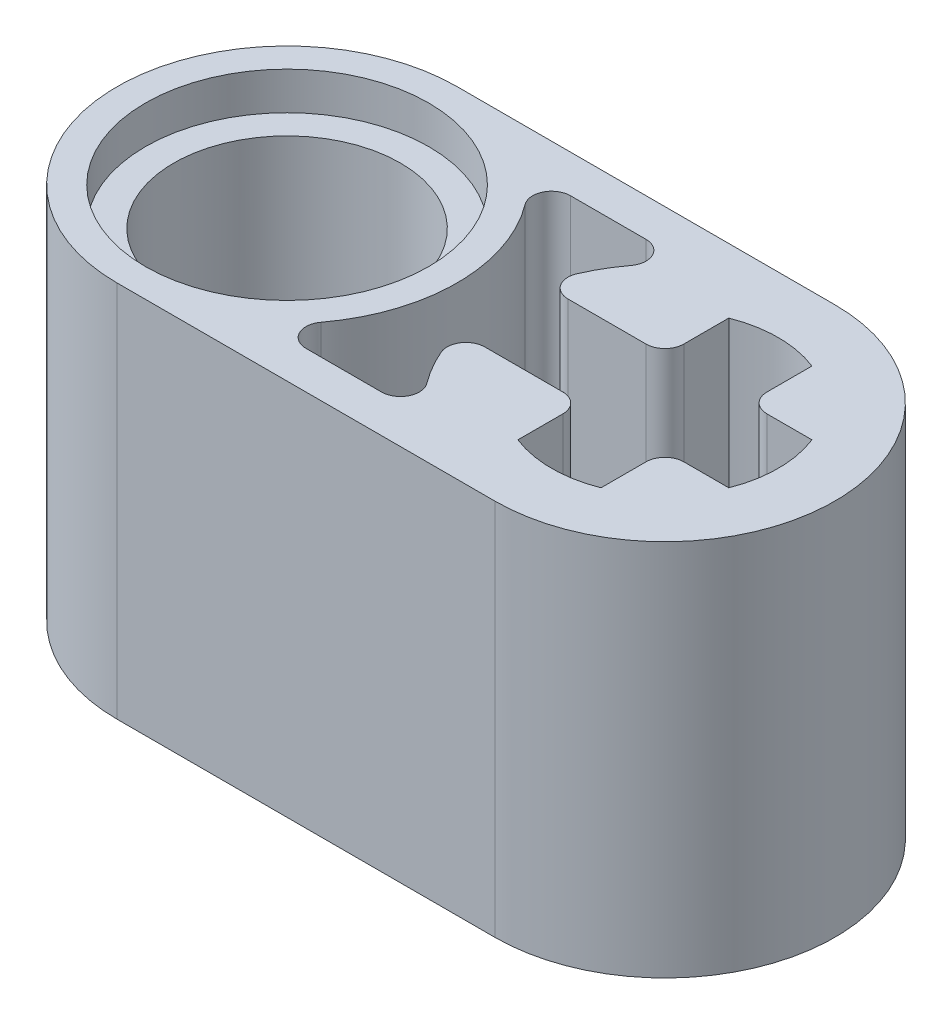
SolidWorks part; units mm, degrees
ref_plane "Front Plane" through (0, 0, 0) normal (0, 0, 1) x (1, 0, 0)
ref_plane "Top Plane" through (0, 0, 0) normal (0, 1, 0) x (1, 0, 0)
ref_plane "Right Plane" through (0, 0, 0) normal (1, 0, 0) x (0, 0, -1)
sketch "Sketch1" plane through (0, 0, 0) normal (0, 1, 0) x (1, 0, 0)
  line L2 (3.12, 2.2328) -> (3.12, 1.28)
  line L3 (4.88, -2.2328) -> (4.88, -1.28)
  line L4 (6.2328, 0.88) -> (5.28, 0.88)
  line L5 (1.7672, -0.88) -> (2.72, -0.88)
  line L6 (5.28, -0.88) -> (6.2328, -0.88)
  line L7 (3.12, -1.28) -> (3.12, -2.2328)
  line L8 (2.72, 0.88) -> (1.7672, 0.88)
  line L9 (4.88, 1.28) -> (4.88, 2.2328)
  line L10 (-4, 3.6) -> (4, 3.6)
  line L11 (-4, -3.6) -> (4, -3.6)
  line L12 (-0.8, 2.8) -> (0.8, 2.8)
  line L13 (-0.8, -2.8) -> (0.8, -2.8)
  line L14 (1.7672, 0.88) -> (1.0672, 0.88)
  line L15 (1.7672, -0.88) -> (1.0672, -0.88)
  circle A0 centre (-4, 0) radius 2.4
  arc A4 (4.88, 2.2328) -> (3.12, 2.2328) centre (4, 0) ccw
  arc A5 (6.2328, -0.88) -> (6.2328, 0.88) centre (4, 0) ccw
  arc A6 (3.12, -2.2328) -> (4.88, -2.2328) centre (4, 0) ccw
  arc A7 (5.28, -0.88) -> (4.88, -1.28) centre (5.28, -1.28) ccw
  arc A8 (2.72, -0.88) -> (3.12, -1.28) centre (2.72, -1.28) cw
  arc A9 (5.28, 0.88) -> (4.88, 1.28) centre (5.28, 1.28) cw
  arc A10 (3.12, 1.28) -> (2.72, 0.88) centre (2.72, 1.28) cw
  arc A12 (-4, 3.6) -> (-4, -3.6) centre (-4, 0) ccw
  arc A13 (1.12, 2.16) -> (0.7005, 1.44) centre (4, 0) ccw
  arc A14 (-1.12, -2.16) -> (-1.12, 2.16) centre (-4, 0) ccw
  arc A15 (4, -3.6) -> (4, 3.6) centre (4, 0) ccw
  arc A16 (-0.8, -2.8) -> (-1.12, -2.16) centre (-0.8, -2.4) cw
  arc A17 (0.8, -2.8) -> (1.12, -2.16) centre (0.8, -2.4) ccw
  arc A18 (0.8, 2.8) -> (1.12, 2.16) centre (0.8, 2.4) cw
  arc A19 (-0.8, 2.8) -> (-1.12, 2.16) centre (-0.8, 2.4) ccw
  arc A20 (0.7005, -1.44) -> (1.12, -2.16) centre (4, 0) ccw
  arc A21 (1.0672, -0.88) -> (0.7005, -1.44) centre (1.0672, -1.28) ccw
  arc A22 (1.0672, 0.88) -> (0.7005, 1.44) centre (1.0672, 1.28) cw
  point P26 (3.12, -0.88)
  point P29 (4.88, 0.88)
  point P32 (3.12, 0.88)
  point P34 (-1.7373, -2.8)
  point P48 (0.5092, -0.88)
  dimension "D3" = 4.8
  dimension "D4" = 0.4
  dimension "D5" = 0.88
  dimension "D9" = 0.4
  dimension "D10" = 0
  dimension "D14" = 0.4
  dimension "D2" = 4
  dimension "D6" = 1.76
  dimension "D7" = 0.88
  dimension "D8" = 1.76
  dimension "D11" = 0
  dimension "D12" = 0.8
  dimension "D13" = 0.8
extrude "Boss-Extrude1" add sketch "Sketch1" along normal blind 8
sketch "Sketch2" plane through (0, 8, 0) normal (0, 1, 0) x (1, 0, 0)
  circle A0 centre (-4, 0) radius 3
extrude "Cut-Extrude1" cut sketch "Sketch2" against normal blind 0.8
sketch "Sketch3" plane through (0, 0, 0) normal (0, -1, 0) x (1, 0, 0)
  circle A0 centre (-4, 0) radius 3
extrude "Cut-Extrude2" cut sketch "Sketch3" against normal blind 0.8
